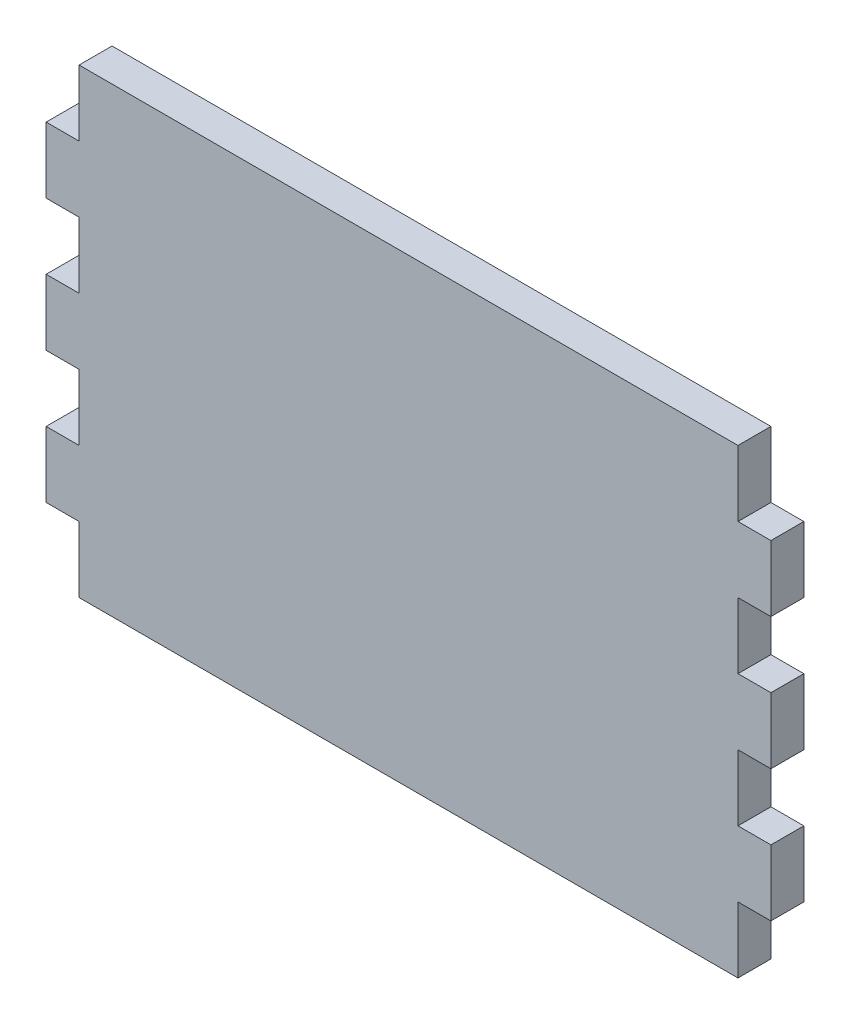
SolidWorks part; units mm, degrees
ref_plane "Plan de face" through (0, 0, 0) normal (0, 0, 1) x (1, 0, 0)
ref_plane "Plan de dessus" through (0, 0, 0) normal (0, 1, 0) x (1, 0, 0)
ref_plane "Plan de droite" through (0, 0, 0) normal (1, 0, 0) x (0, 0, -1)
sketch "Esquisse1" plane through (0, 0, 0) normal (0, 0, 1) x (1, 0, 0)
  line L1 (-50, -35) -> (50, -35)
  line L2 (-50, -35) -> (-50, 35)
  line L3 (-50, 35) -> (50, 35)
  line L4 (50, -35) -> (50, 35)
  line L5 (-50, -35) -> (50, 35) construction
  line L6 (-50, 35) -> (50, -35) construction
  point P0 (0, 0)
  dimension "D1" = 100
  dimension "D2" = 70
extrude "Boss.-Extru.1" add sketch "Esquisse1" along normal blind 5
sketch "Esquisse2" plane through (50, 0, 0) normal (1, 0, 0) x (0, 0, -1)
  line L0 (-5, -35) -> (-5, 35) construction
  line L1 (-5, -25) -> (0, -25)
  line L2 (-5, -25) -> (-5, -15)
  line L3 (-5, -15) -> (0, -15)
  line L4 (0, -25) -> (0, -15)
  line L5 (0, -35) -> (0, 35) construction
  line L6 (-5, -35) -> (0, -35) construction
  line L7 (-5, -5) -> (0, -5)
  line L8 (-5, -5) -> (-5, 5)
  line L9 (-5, 5) -> (0, 5)
  line L10 (0, -5) -> (0, 5)
  line L11 (-5, 15) -> (0, 15)
  line L12 (-5, 15) -> (-5, 25)
  line L13 (-5, 25) -> (0, 25)
  line L14 (0, 15) -> (0, 25)
  dimension "D1" = 10
  dimension "D2" = 10
  dimension "D3" = 3
extrude "Boss.-Extru.2" add sketch "Esquisse2" along normal blind 5 and the other way blind 105
